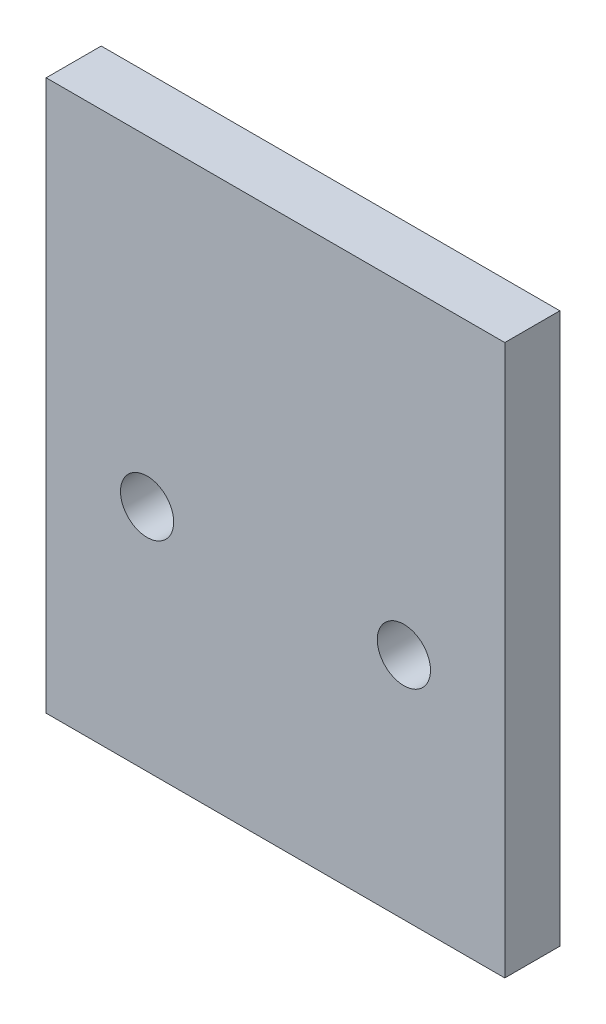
SolidWorks part; units mm, degrees
ref_plane "Спереди" through (0, 0, 0) normal (0, 0, 1) x (1, 0, 0)
ref_plane "Сверху" through (0, 0, 0) normal (0, 1, 0) x (1, 0, 0)
ref_plane "Справа" through (0, 0, 0) normal (1, 0, 0) x (0, 0, -1)
sketch "Эскиз1" plane through (0, 0, 0) normal (0, 0, 1) x (1, 0, 0)
  line L0 (12.5, 30) -> (12.5, 0) construction
  line L1 (0, 0) -> (25, 0)
  line L2 (0, 0) -> (0, 30)
  line L3 (0, 30) -> (25, 30)
  line L4 (25, 0) -> (25, 30)
  circle A0 centre (19.5, 12.5) radius 1.45
  circle A1 centre (5.5, 12.5) radius 1.45
  dimension "D2" = 14
  dimension "D3" = 2.9
  dimension "D4" = 12.5
  dimension "D1" = 25
  dimension "D5" = 30
extrude "Бобышка-Вытянуть1" add sketch "Эскиз1" along normal blind 3
